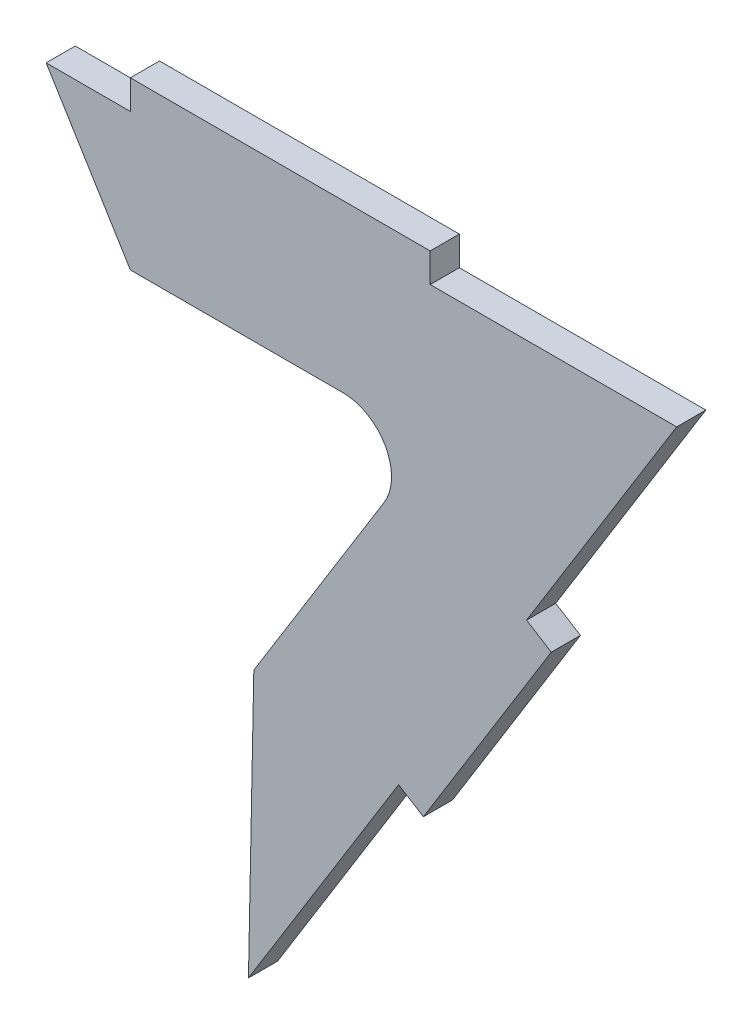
SolidWorks part; units mm, degrees
ref_plane "Front Plane" through (0, 0, 0) normal (0, 0, 1) x (1, 0, 0)
ref_plane "Top Plane" through (0, 0, 0) normal (0, 1, 0) x (1, 0, 0)
ref_plane "Right Plane" through (0, 0, 0) normal (1, 0, 0) x (0, 0, -1)
sketch "Sketch1" plane through (0, 0, 0) normal (0, 0, 1) x (1, 0, 0)
  line L0 (44.6498, 0) -> (44.6498, 1.524)
  line L1 (44.6498, 1.524) -> (60.3267, 1.524)
  line L2 (60.3267, 1.524) -> (60.3267, 0)
  line L3 (60.3267, 0) -> (73.2149, 0)
  line L4 (73.2149, 0) -> (65.3632, -12.6762)
  line L6 (51.1053, -22.0658) -> (57.925, -11.0557)
  line L7 (55.7656, -7.1782) -> (44.6498, -7.1782)
  line L8 (50.824, -36.1491) -> (51.1053, -22.0658)
  line L10 (40.2472, 0) -> (44.6498, 0)
  line L11 (66.6588, -13.4787) -> (59.9713, -24.2754)
  line L12 (58.6757, -23.4729) -> (59.9713, -24.2754)
  line L13 (65.3632, -12.6762) -> (66.6588, -13.4787)
  line L14 (58.6757, -23.4729) -> (50.824, -36.1491)
  line L15 (40.2472, 0) -> (44.6498, -7.1782)
  arc A0 (57.925, -11.0557) -> (55.7656, -7.1782) centre (55.7656, -9.7182) ccw
extrude "Boss-Extrude1" add sketch "Sketch1" along normal blind 1.524
